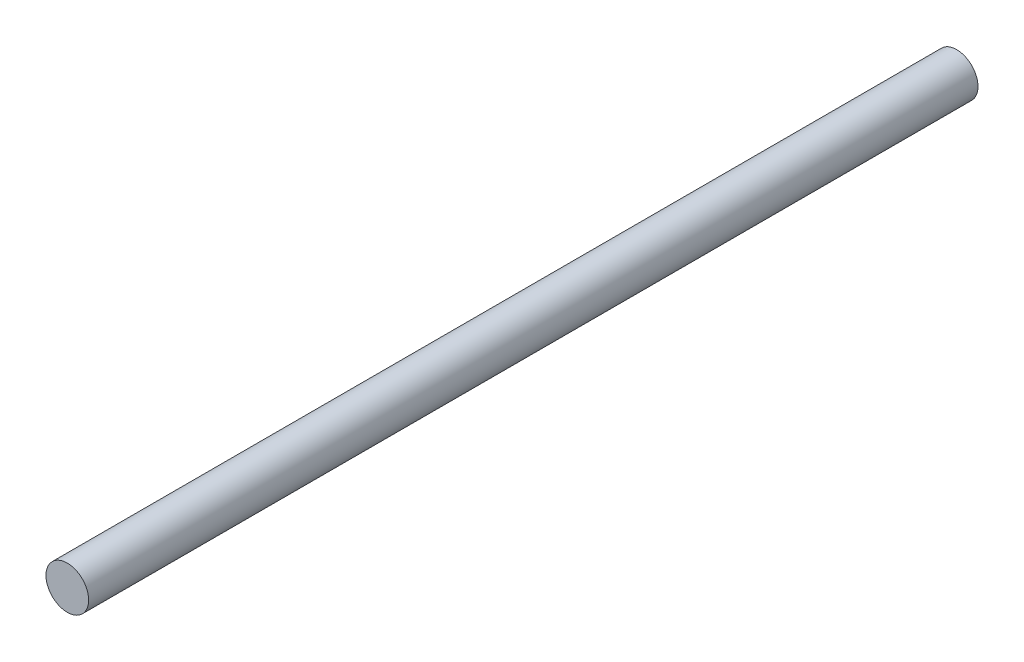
SolidWorks part; units mm, degrees
ref_plane "Front Plane" through (0, 0, 0) normal (0, 0, 1) x (1, 0, 0)
ref_plane "Top Plane" through (0, 0, 0) normal (0, 1, 0) x (1, 0, 0)
ref_plane "Right Plane" through (0, 0, 0) normal (1, 0, 0) x (0, 0, -1)
sketch "Sketch1" plane through (0, 0, 0) normal (0, 0, 1) x (1, 0, 0)
  circle A0 centre (0, 0) radius 30
  dimension "D1" = 60
extrude "Boss-Extrude1" add sketch "Sketch1" against normal blind 1250
